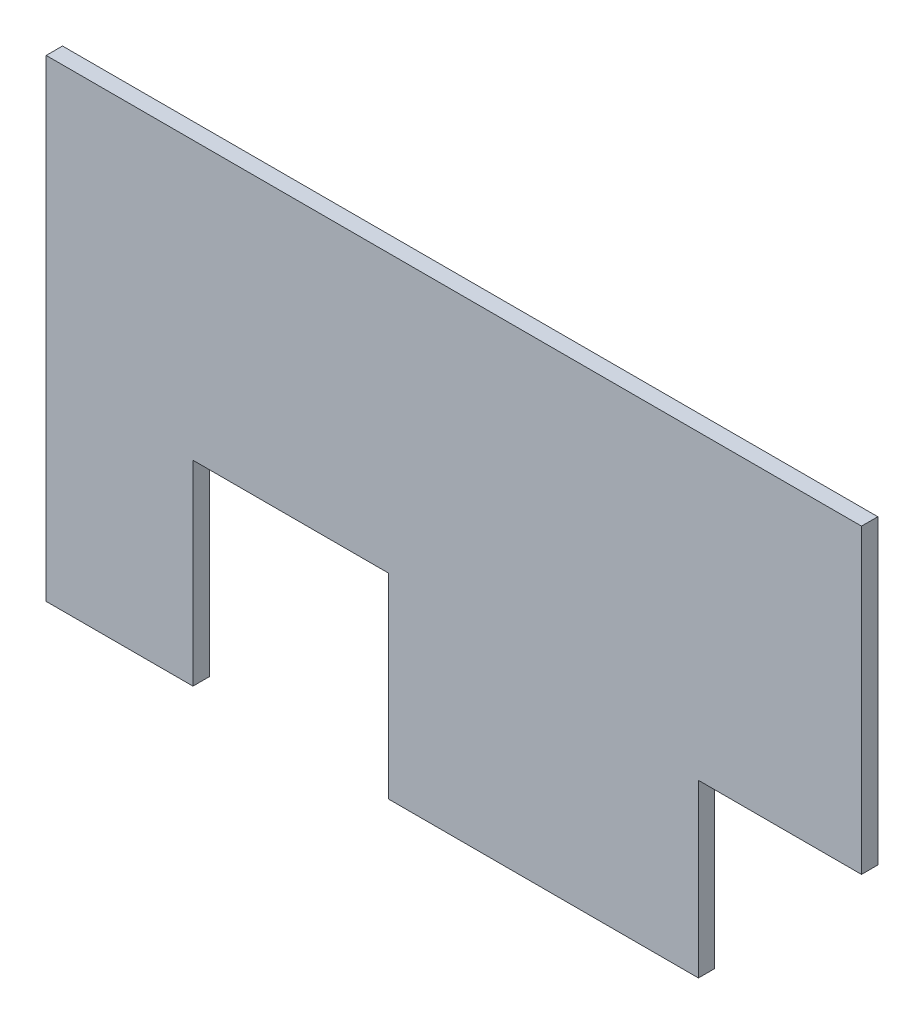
SolidWorks part; units mm, degrees
ref_plane "Plan de face" through (0, 0, 0) normal (0, 0, 1) x (1, 0, 0)
ref_plane "Plan de dessus" through (0, 0, 0) normal (0, 1, 0) x (1, 0, 0)
ref_plane "Plan de droite" through (0, 0, 0) normal (1, 0, 0) x (0, 0, -1)
sketch "Esquisse1" plane through (0, 0, 0) normal (0, 0, 1) x (1, 0, 0)
  line L1 (0, 0) -> (50, 0)
  line L2 (0, 0) -> (0, 29)
  line L3 (0, 29) -> (50, 29)
  line L4 (50, 0) -> (50, 29)
  dimension "D1" = 50
  dimension "D2" = 29
extrude "Boss.-Extru.1" add sketch "Esquisse1" along normal blind 1
sketch "Esquisse2" plane through (0, 0, 1) normal (0, 0, 1) x (1, 0, 0)
  line L0 (0, 0) -> (9, 0) construction
  line L1 (0, 0) -> (50, 0) construction
  line L3 (9, 0) -> (21, 0)
  line L4 (9, 0) -> (9, 12)
  line L5 (9, 12) -> (21, 12)
  line L6 (21, 0) -> (21, 12)
  dimension "D1" = 9
  dimension "D2" = 12
  dimension "D3" = 12
extrude "Enlèv. mat.-Extru.1" cut sketch "Esquisse2" against normal blind 1.5
sketch "Esquisse3" plane through (0, 0, 1) normal (0, 0, 1) x (1, 0, 0)
  line L0 (21, 0) -> (40, 0) construction
  line L1 (21, 0) -> (50, 0) construction
  line L2 (50, 0) -> (50, 29) construction
  line L3 (40, 0) -> (50, 0)
  line L4 (40, 0) -> (40, 10.5)
  line L5 (40, 10.5) -> (50, 10.5)
  line L6 (50, 0) -> (50, 10.5)
  dimension "D1" = 19
  dimension "D2" = 10.5
extrude "Enlèv. mat.-Extru.2" cut sketch "Esquisse3" against normal blind 1.5
